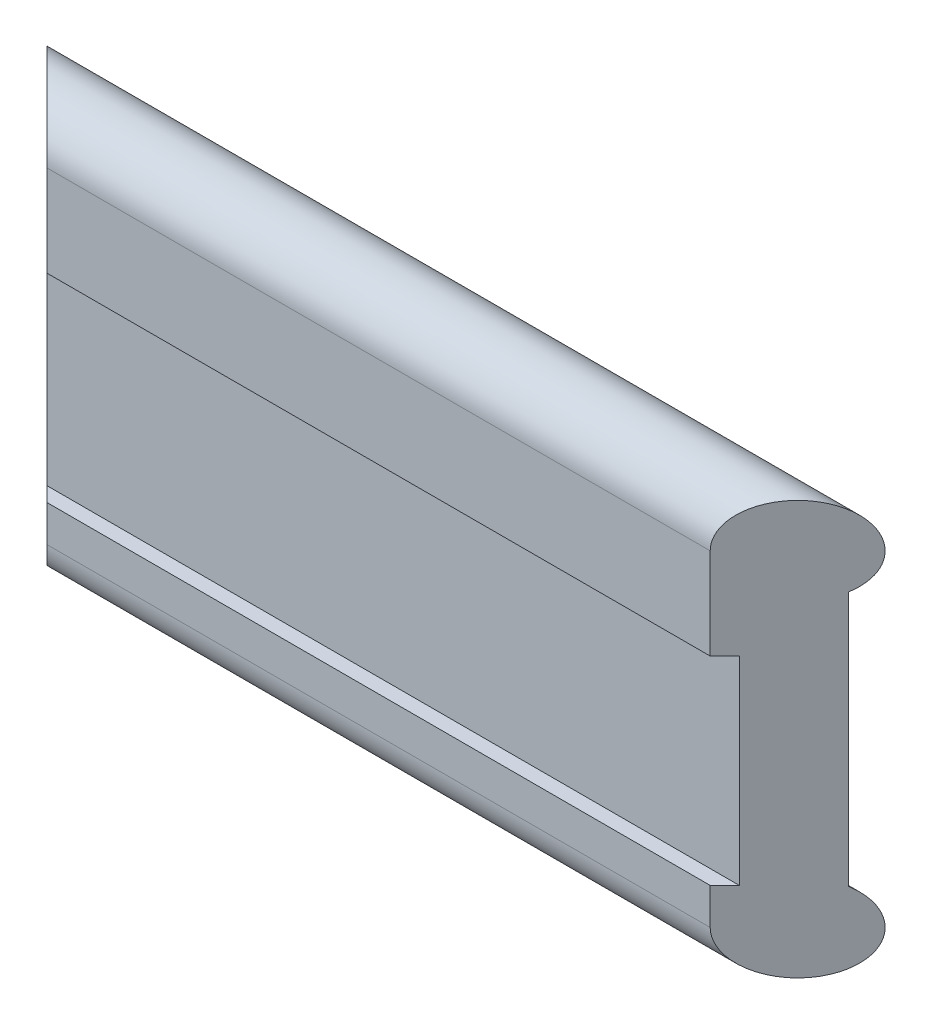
SolidWorks part; units mm, degrees
ref_plane "Front Plane" through (0, 0, 0) normal (0, 0, 1) x (1, 0, 0)
ref_plane "Top Plane" through (0, 0, 0) normal (0, 1, 0) x (1, 0, 0)
ref_plane "Right Plane" through (0, 0, 0) normal (1, 0, 0) x (0, 0, -1)
sketch "Sketch1" plane through (0, 0, 0) normal (0, 0, 1) x (1, 0, 0)
  line L1 (-115, -27.25) -> (115, -27.25)
  line L2 (-115, -27.25) -> (-115, 27.25)
  line L3 (-115, 27.25) -> (115, 27.25)
  line L4 (115, -27.25) -> (115, 27.25)
  line L5 (-115, -27.25) -> (115, 27.25) construction
  line L6 (-115, 27.25) -> (115, -27.25) construction
  point P0 (0, 0)
  dimension "D1" = 230
  dimension "D2" = 54.5
extrude "Boss-Extrude1" add sketch "Sketch1" along normal blind 15
sketch "Sketch2" plane through (-115, 0, 0) normal (-1, 0, 0) x (0, 0, 1)
  line L0 (15, 27.25) -> (19, 27.25)
  line L1 (19, 27.25) -> (19, 52.25)
  line L2 (0, 42.5032) -> (0, 27.25)
  line L3 (0, 27.25) -> (15, 27.25)
  line L4 (0, -27.25) -> (15, -27.25)
  line L5 (15, -27.25) -> (19, -27.25)
  line L6 (19, -27.25) -> (19, -37.25)
  line L7 (0, -27.5032) -> (0, -27.25)
  arc A0 (19, 52.25) -> (0, 42.5032) centre (7, 52.25) ccw
  arc A1 (19, -37.25) -> (0, -27.5032) centre (7, -37.25) cw
  dimension "D3" = 12
  dimension "D5" = 12
  dimension "D1" = 4
  dimension "D2" = 25
  dimension "D4" = 10
extrude "Boss-Extrude2" add sketch "Sketch2" against normal up to surface (230 mm away)
sketch "Sketch3" plane through (0, 0, 0) normal (0, 1, 0) x (1, 0, 0)
  line L0 (-115, 5) -> (-91, -19)
  line L1 (115, -19) -> (-115, -19) construction
  line L2 (-91, -19) -> (0, -19)
  line L3 (0, -19) -> (91, -19)
  line L4 (91, -19) -> (115, 5)
  line L5 (115, 5) -> (115, -29)
  line L6 (115, -29) -> (-115, -29)
  line L7 (-115, -29) -> (-115, 5)
  dimension "D1" = 45
  dimension "D2" = 10
extrude "Cut-Extrude1" cut sketch "Sketch3" against normal through all and the other way through all
